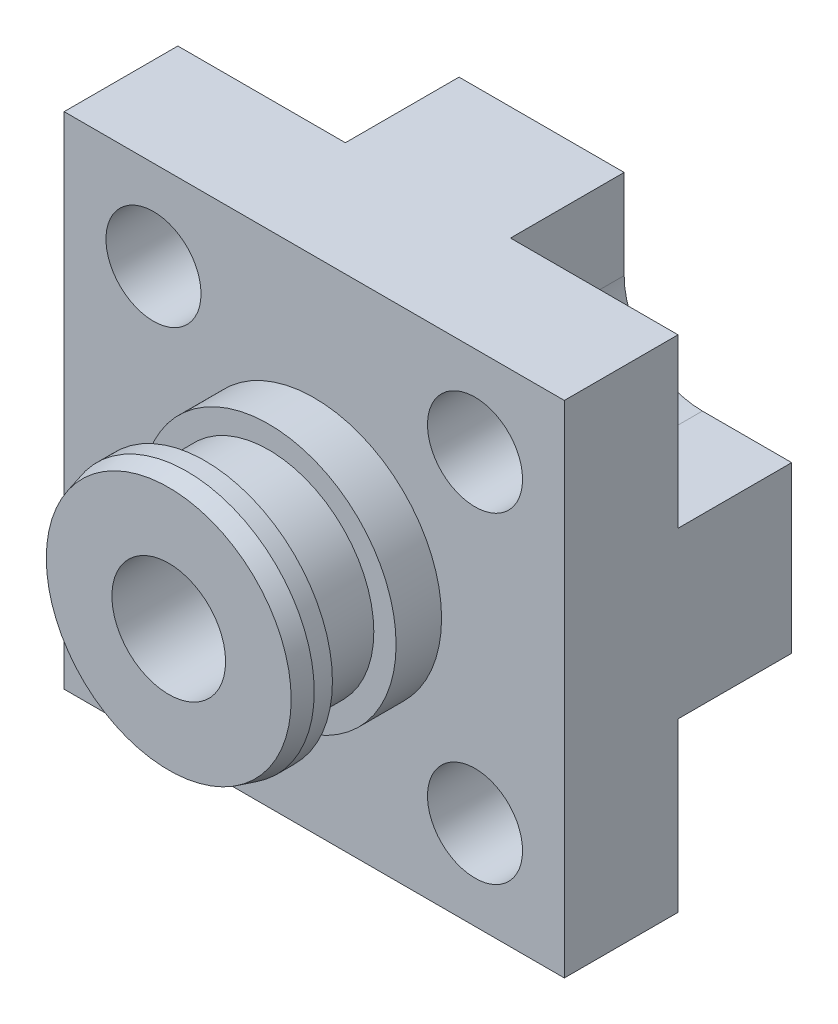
SolidWorks part; units mm, degrees
ref_plane "Front Plane" through (0, 0, 0) normal (0, 0, 1) x (1, 0, 0)
ref_plane "Top Plane" through (0, 0, 0) normal (0, 1, 0) x (1, 0, 0)
ref_plane "Right Plane" through (0, 0, 0) normal (1, 0, 0) x (0, 0, -1)
sketch "Sketch1" plane through (0, 0, 0) normal (0, 0, 1) x (1, 0, 0)
  line L0 (0, 0) -> (0, 13.97) construction
  line L1 (-13.97, 13.97) -> (13.97, 13.97)
  line L2 (13.97, 13.97) -> (13.97, -13.97)
  line L3 (-13.97, 13.97) -> (-13.97, -13.97)
  line L4 (0, 0) -> (13.97, 0) construction
  line L5 (-13.97, -13.97) -> (13.97, -13.97)
  point P9 (-13.97, 0)
  dimension "D2" = 13.97
  dimension "D3" = 13.97
extrude "base" add sketch "Sketch1" along normal blind 12.7
sketch "Sketch2" plane through (0, 0, 12.7) normal (0, 0, 1) x (1, 0, 0)
  circle A0 centre (0, 0) radius 7.112
  dimension "D1" = 14.224
extrude "plug_dia1" add sketch "Sketch2" along normal blind 2.54
sketch "Sketch3" plane through (0, 0, 15.24) normal (0, 0, 1) x (1, 0, 0)
  circle A0 centre (0, 0) radius 5.8674
  dimension "D1" = 11.7348
extrude "groove_dia" add sketch "Sketch3" along normal blind 3.556
sketch "Sketch4" plane through (0, 0, 18.796) normal (0, 0, 1) x (1, 0, 0)
  circle A0 centre (0, 0) radius 7.112
  dimension "D1" = 14.224
extrude "plug_dia2" add sketch "Sketch4" along normal blind 2.032
sketch "Sketch7" plane through (0, -13.97, 0) normal (0, -1, 0) x (1, 0, 0)
  line L0 (-13.97, 0) -> (13.97, 0) construction
  circle A0 centre (0, 6.35) radius 2.3813
  dimension "D1" = 4.7625
  dimension "D2" = 6.35
extrude "bottom_port" cut sketch "Sketch7" against normal blind 15.24
sketch "Sketch8" plane through (0, -13.97, 0) normal (0, -1, 0) x (1, 0, 0)
  circle A0 centre (0, 6.35) radius 3.175
  dimension "D1" = 6.35
extrude "bottom_weld" cut sketch "Sketch8" against normal blind 6.35
sketch "Sketch12" plane through (0, 0, 12.7) normal (0, 0, 1) x (1, 0, 0)
  line L0 (0, 0) -> (15.24, 0) construction
  line L1 (0, 0) -> (8.9803, 8.9803) construction
  circle A0 centre (0, 0) radius 12.7 construction
  circle A1 centre (8.9803, 8.9803) radius 2.6543
  circle A2 centre (8.9803, -8.9803) radius 2.6543
  circle A3 centre (-8.9803, -8.9803) radius 2.6543
  circle A4 centre (-8.9803, 8.9803) radius 2.6543
  dimension "D3" = 5.3086
  dimension "D4" = 25.4
  dimension "D2" = 45
extrude "bolt_circle" cut sketch "Sketch12" against normal through all
sketch "Sketch13" plane through (0, 0, 0) normal (0, 0, -1) x (-1, 0, 0)
  line L0 (8.9803, 8.9803) -> (4.6115, 8.9803) construction
  line L1 (8.9803, 8.9803) -> (8.9803, 4.6115) construction
  line L2 (4.6115, 8.9803) -> (4.6115, 17.9627)
  line L3 (8.9803, 4.6115) -> (18.1815, 4.6115)
  line L4 (0, 0) -> (0, 6.8076) construction
  line L5 (0, 0) -> (6.2655, 0) construction
  line L6 (18.1815, 4.6115) -> (18.1815, 17.9627)
  line L7 (18.1815, 17.9627) -> (4.6115, 17.9627)
  line L8 (-8.9803, 4.6115) -> (-18.1815, 4.6115)
  line L9 (-18.1815, 4.6115) -> (-18.1815, 17.9627)
  line L10 (-18.1815, 17.9627) -> (-4.6115, 17.9627)
  line L11 (-4.6115, 8.9803) -> (-4.6115, 17.9627)
  line L12 (-8.9803, -4.6115) -> (-18.1815, -4.6115)
  line L13 (-18.1815, -4.6115) -> (-18.1815, -17.9627)
  line L14 (-18.1815, -17.9627) -> (-4.6115, -17.9627)
  line L15 (-4.6115, -8.9803) -> (-4.6115, -17.9627)
  line L16 (8.9803, -4.6115) -> (18.1815, -4.6115)
  line L17 (18.1815, -4.6115) -> (18.1815, -17.9627)
  line L18 (18.1815, -17.9627) -> (4.6115, -17.9627)
  line L19 (4.6115, -8.9803) -> (4.6115, -17.9627)
  arc A0 (4.6115, 8.9803) -> (8.9803, 4.6115) centre (8.9803, 8.9803) ccw
  arc A1 (-4.6115, 8.9803) -> (-8.9803, 4.6115) centre (-8.9803, 8.9803) cw
  arc A2 (-4.6115, -8.9803) -> (-8.9803, -4.6115) centre (-8.9803, -8.9803) ccw
  arc A3 (4.6115, -8.9803) -> (8.9803, -4.6115) centre (8.9803, -8.9803) cw
  dimension "D1" = 8.7376
extrude "bolt__cbore" cut sketch "Sketch13" against normal blind 6.35
chamfer "Chamfer1" distance 1.016 angle 15 1 edges at (7.112, 0, 20.828)
sketch "Sketch14" plane through (0, 0, 20.828) normal (0, 0, 1) x (1, 0, 0)
  circle A0 centre (0, 0) radius 3.175
  dimension "D1" = 6.35
extrude "center_cbore" cut sketch "Sketch14" against normal blind 17.018
